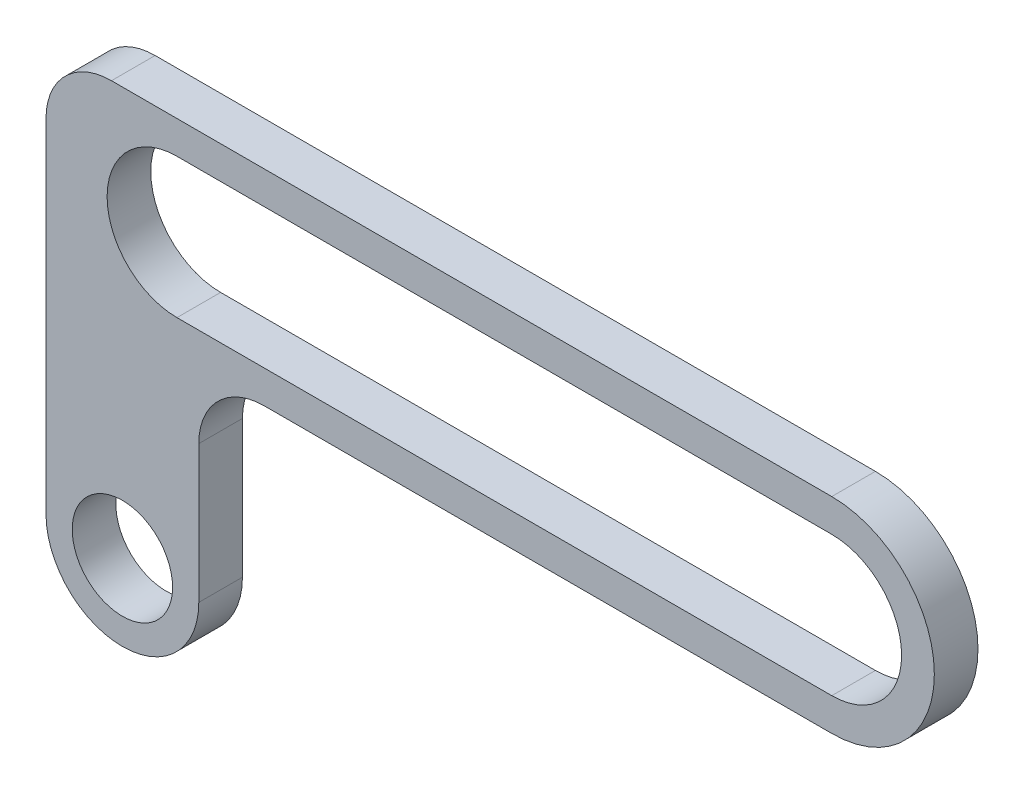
SolidWorks part; units mm, degrees
ref_plane "Plan de face" through (0, 0, 0) normal (0, 0, 1) x (1, 0, 0)
ref_plane "Plan de dessus" through (0, 0, 0) normal (0, 1, 0) x (1, 0, 0)
ref_plane "Plan de droite" through (0, 0, 0) normal (1, 0, 0) x (0, 0, -1)
sketch "Esquisse1" plane through (0, 0, 0) normal (0, 0, 1) x (1, 0, 0)
  line L0 (25, 172) -> (325, 172)
  line L1 (325, 108) -> (25, 108)
  line L2 (-35, 0) -> (-35, 187)
  line L3 (-35, 187) -> (325, 187)
  line L5 (325, 93) -> (35, 93)
  line L6 (35, 93) -> (35, 0)
  circle A0 centre (0, 0) radius 23
  arc A1 (25, 172) -> (25, 108) centre (25, 140) ccw
  arc A2 (325, 108) -> (325, 172) centre (325, 140) ccw
  arc A3 (-35, 0) -> (35, 0) centre (0, 0) ccw
  arc A4 (325, 93) -> (325, 187) centre (325, 140) ccw
  dimension "D2" = 46
  dimension "D3" = 64
  dimension "D5" = 70
  dimension "D8" = 15
  dimension "D6" = 15
  dimension "D7" = 32
  dimension "D1" = 140
  dimension "D4" = 25
  dimension "D9" = 300
  dimension "D10" = 15
extrude "Boss.-Extru.1" add sketch "Esquisse1" along normal blind 20
fillet "Congé1" radius 30 2 edges at (-35, 187, 10) (35, 93, 10)
